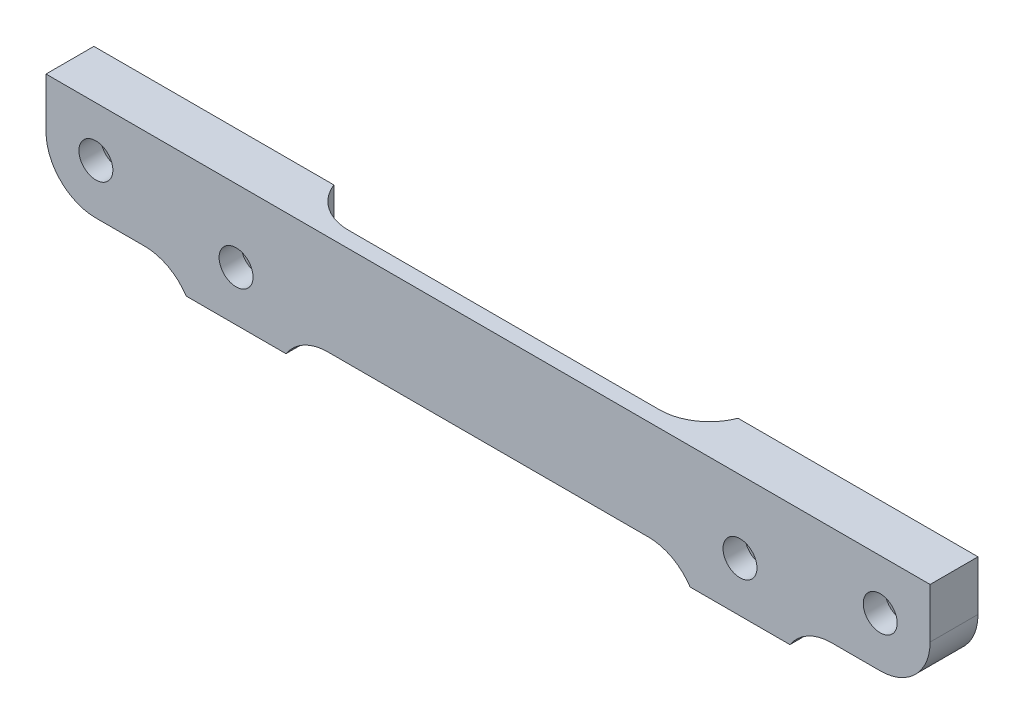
SolidWorks part; units mm, degrees
ref_plane "Front Plane" through (0, 0, 0) normal (0, 0, 1) x (1, 0, 0)
ref_plane "Top Plane" through (0, 0, 0) normal (0, 1, 0) x (1, 0, 0)
ref_plane "Right Plane" through (0, 0, 0) normal (1, 0, 0) x (0, 0, -1)
sketch "Sketch1" plane through (0, 0, 0) normal (0, 0, 1) x (1, 0, 0)
  line L1 (-15.9085, 3.0664) -> (72.6915, 3.0664)
  line L2 (-15.9085, 3.0664) -> (-15.9085, -6.9336)
  line L3 (-15.9085, -6.9336) -> (72.6915, -6.9336)
  line L4 (72.6915, 3.0664) -> (72.6915, -6.9336)
  circle A0 centre (-10.9085, -1.9336) radius 1.7
  circle A1 centre (67.6915, -1.9336) radius 1.7
  point P8 (-12.6001, 0)
  dimension "D1" = 3.4
  dimension "D2" = 3.4
  dimension "D3" = 10
  dimension "D4" = 5
  dimension "D5" = 5
  dimension "D6" = 5
  dimension "D7" = 5
  dimension "D8" = 78.6
extrude "Boss-Extrude1" add sketch "Sketch1" along normal blind 1.6
sketch "Sketch2" plane through (0, 0, 0) normal (0, 0, 1) x (1, 0, 0)
  line L0 (-15.9085, 3.0664) -> (-15.9085, -6.9336) construction
  line L1 (-1.6085, 0.5664) -> (58.3915, 0.5664)
  line L2 (-1.6085, 0.5664) -> (-1.6085, -59.4336)
  line L3 (-1.6085, -59.4336) -> (58.3915, -59.4336)
  line L4 (58.3915, 0.5664) -> (58.3915, -59.4336)
  circle A0 centre (3.1415, -4.1836) radius 2.25
  circle A1 centre (53.6415, -4.1836) radius 2.25
  circle A2 centre (3.1415, -54.6836) radius 2.25
  circle A3 centre (53.6415, -54.6836) radius 2.25
  circle A4 centre (67.6915, -56.9336) radius 1.7
  circle A5 centre (-10.9085, -56.9336) radius 1.7
  point P16 (0, 0)
  dimension "D1" = 4.5
  dimension "D2" = 4.5
  dimension "D3" = 4.5
  dimension "D4" = 4.5
  dimension "D13" = 55
  dimension "D14" = 55
  dimension "D15" = 3.4
  dimension "D16" = 3.4
  dimension "D5" = 50.5
  dimension "D6" = 50.5
  dimension "D7" = 50.5
  dimension "D8" = 50.5
  dimension "D9" = 60
  dimension "D10" = 60
  dimension "D11" = 4.75
  dimension "D12" = 4.75
  dimension "D17" = 78.6
  dimension "D18" = 2.5
  dimension "D19" = 14.3
sketch "Sketch3" plane through (0, 0, 0) normal (0, 0, 1) x (1, 0, 0)
  line L0 (-15.9085, -6.9336) -> (72.6915, -6.9336) construction
  line L1 (-1.8585, -6.9336) -> (8.1415, -6.9336)
  line L2 (-1.8585, -6.9336) -> (-1.8585, -9.1836)
  line L3 (-1.8585, -9.1836) -> (8.1415, -9.1836)
  line L4 (8.1415, -6.9336) -> (8.1415, -9.1836)
  line L6 (48.6415, -6.9336) -> (58.6415, -6.9336)
  line L7 (48.6415, -6.9336) -> (48.6415, -9.1836)
  line L8 (48.6415, -9.1836) -> (58.6415, -9.1836)
  line L9 (58.6415, -6.9336) -> (58.6415, -9.1836)
  dimension "D1" = 10
  dimension "D2" = 10
  dimension "D3" = 5
  dimension "D4" = 5
  dimension "D5" = 5
  dimension "D6" = 5
extrude "Boss-Extrude2" add sketch "Sketch3" along normal blind 1.6
sketch "Sketch4" plane through (0, 0, 0) normal (0, 0, 1) x (1, 0, 0)
  circle A0 centre (3.1415, -4.1836) radius 1.7
  circle A1 centre (53.6415, -4.1836) radius 1.7
  dimension "D1" = 3.4
  dimension "D2" = 3.4
extrude "Cut-Extrude1" cut sketch "Sketch4" along normal blind 1.6
sketch "Sketch5" plane through (0, 0, 0) normal (0, 0, 1) x (1, 0, 0)
  line L0 (-15.9085, -6.9336) -> (-1.8585, -6.9336)
  line L1 (-15.9085, 3.0664) -> (8.1415, 3.0664)
  line L2 (-15.9085, 3.0664) -> (-15.9085, -6.9336)
  line L3 (-1.8585, -6.9336) -> (-1.8585, -9.1836)
  line L4 (8.1415, 3.0664) -> (8.1415, -6.9336)
  line L5 (-1.8585, -9.1836) -> (8.1415, -9.1836)
  line L6 (8.1415, -9.1836) -> (8.1415, -6.9336)
  line L7 (72.6915, -6.9336) -> (58.6415, -6.9336)
  line L8 (58.6415, -6.9336) -> (58.6415, -9.1836)
  line L9 (58.6415, -9.1836) -> (48.6415, -9.1836)
  line L10 (48.6415, -9.1836) -> (48.6415, 3.0664)
  line L11 (72.6915, 3.0664) -> (-15.9085, 3.0664) construction
  line L12 (48.6415, 3.0664) -> (72.6915, 3.0664)
  line L13 (72.6915, 3.0664) -> (72.6915, -6.9336)
  circle A0 centre (53.6415, -4.1836) radius 1.7
  circle A1 centre (67.6915, -1.9336) radius 1.7
  circle A2 centre (-10.9085, -1.9336) radius 1.7
  circle A3 centre (3.1415, -4.1836) radius 1.7
  dimension "D1" = 3.4
  dimension "D2" = 3.4
  dimension "D3" = 3.4
  dimension "D4" = 3.4
extrude "Boss-Extrude3" add sketch "Sketch5" against normal blind 3.2
fillet "Fillet1" radius 5 4 edges at (48.6415, -6.9336, 0.8) (48.6415, -1.9336, 0) (8.1415, -6.9336, 0.8) (8.1415, -1.9336, 0)
fillet "Fillet2" radius 5 4 edges at (-15.9085, -6.9336, -0.8) (72.6915, -6.9336, -0.8) (58.6415, -6.9336, -0.8) (-1.8585, -6.9336, -0.8)
ref_plane "Plane1" through (0, 0, -3.2) normal (0, 0, -1) x (-1, 0, 0)
sketch "Sketch6" plane through (0, 0, -3.2) normal (0, 0, -1) x (-1, 0, 0)
  line L1 (9.2743, 0.8562) -> (7.6754, -1.954)
  line L2 (7.6754, -1.954) -> (9.3096, -4.7437)
  line L3 (9.3096, -4.7437) -> (12.5427, -4.7233)
  line L4 (12.5427, -4.7233) -> (14.1416, -1.9132)
  line L5 (14.1416, -1.9132) -> (12.5074, 0.8765)
  line L6 (12.5074, 0.8765) -> (9.2743, 0.8562)
  line L7 (-6.3746, -4.1836) -> (-4.7581, -6.9836)
  line L8 (-4.7581, -6.9836) -> (-1.5249, -6.9836)
  line L9 (-1.5249, -6.9836) -> (0.0917, -4.1836)
  line L10 (0.0917, -4.1836) -> (-1.5249, -1.3836)
  line L11 (-1.5249, -1.3836) -> (-4.7581, -1.3836)
  line L12 (-4.7581, -1.3836) -> (-6.3746, -4.1836)
  line L13 (-56.8746, -4.1836) -> (-55.2581, -6.9836)
  line L14 (-55.2581, -6.9836) -> (-52.0249, -6.9836)
  line L15 (-52.0249, -6.9836) -> (-50.4083, -4.1836)
  line L16 (-50.4083, -4.1836) -> (-52.0249, -1.3836)
  line L17 (-52.0249, -1.3836) -> (-55.2581, -1.3836)
  line L18 (-55.2581, -1.3836) -> (-56.8746, -4.1836)
  line L19 (-70.9246, -1.9336) -> (-69.3081, -4.7336)
  line L20 (-69.3081, -4.7336) -> (-66.0749, -4.7336)
  line L21 (-66.0749, -4.7336) -> (-64.4583, -1.9336)
  line L22 (-64.4583, -1.9336) -> (-66.0749, 0.8664)
  line L23 (-66.0749, 0.8664) -> (-69.3081, 0.8664)
  line L24 (-69.3081, 0.8664) -> (-70.9246, -1.9336)
  circle A0 centre (10.9085, -1.9336) radius 2.8 construction
  circle A1 centre (-3.1415, -4.1836) radius 2.8 construction
  circle A2 centre (-53.6415, -4.1836) radius 2.8 construction
  circle A3 centre (-67.6915, -1.9336) radius 2.8 construction
  dimension "D1" = 5.6
  dimension "D2" = 5.6
  dimension "D3" = 5.6
  dimension "D4" = 5.6
extrude "Cut-Extrude2" cut sketch "Sketch6" against normal blind 2.6
ref_plane "Plane2" through (0, 0, 1.6) normal (0, 0, 1) x (1, 0, 0)
sketch "Sketch7" plane through (0, 0, 1.6) normal (0, 0, 1) x (1, 0, 0)
  line L1 (-15.9085, 3.0664) -> (-7.6085, 3.0664)
  line L2 (-15.9085, 3.0664) -> (-15.9085, -9.7353)
  line L3 (-15.9085, -9.7353) -> (-7.6085, -9.7353)
  line L4 (-7.6085, 3.0664) -> (-7.6085, -9.7353)
  line L5 (72.6915, 3.0664) -> (64.3915, 3.0664)
  line L6 (72.6915, 3.0664) -> (72.6915, -10.6176)
  line L7 (72.6915, -10.6176) -> (64.3915, -10.6176)
  line L8 (64.3915, 3.0664) -> (64.3915, -10.6176)
  dimension "D1" = 72
  dimension "D2" = 8.3
